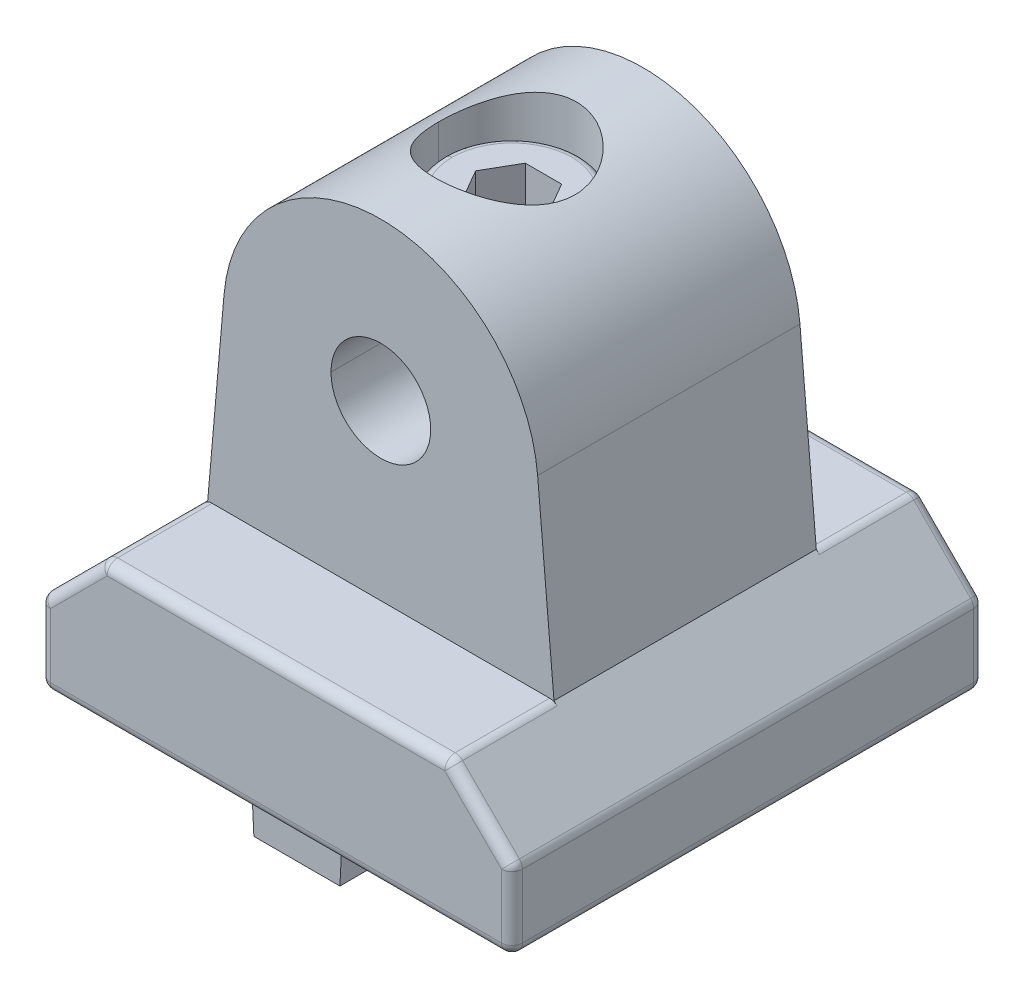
SolidWorks part; units mm, degrees
ref_plane "Front Plane" through (0, 0, 0) normal (0, 0, 1) x (1, 0, 0)
ref_plane "Top Plane" through (0, 0, 0) normal (0, 1, 0) x (1, 0, 0)
ref_plane "Right Plane" through (0, 0, 0) normal (1, 0, 0) x (0, 0, -1)
imported_body "Kanta"
imported_body "Kierre"
imported_body "P"
imported_body "Kierronestolevy"
imported_body "Runko"
fillet "Fillet1" radius 1
